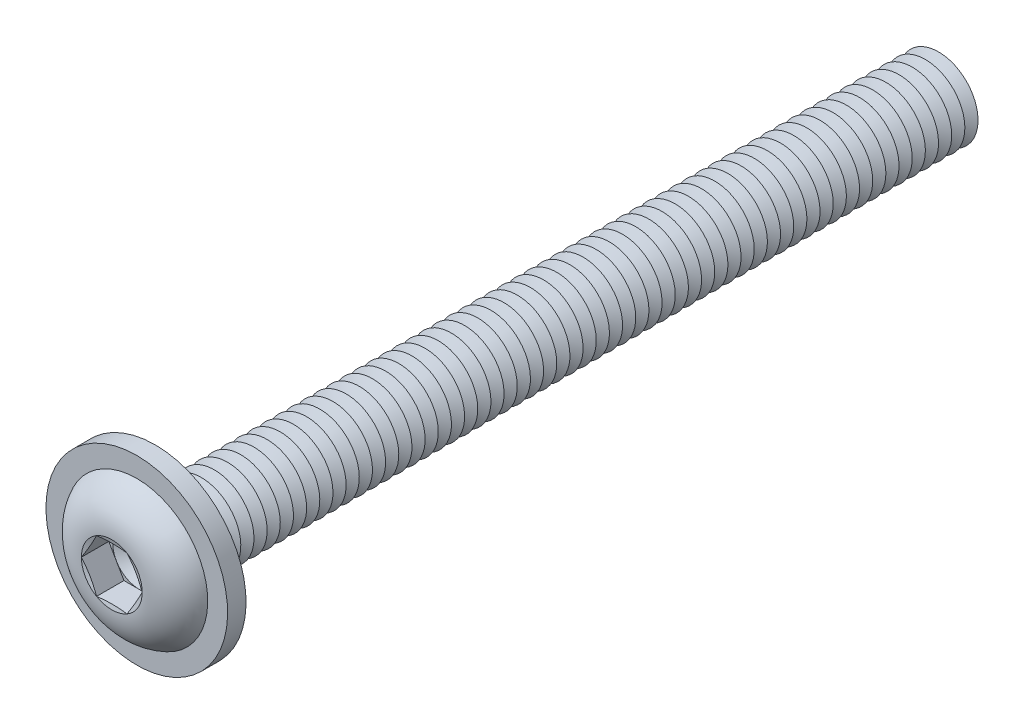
SolidWorks part; units mm, degrees
ref_plane "Front Plane" through (0, 0, 0) normal (0, 0, 1) x (1, 0, 0)
ref_plane "Top Plane" through (0, 0, 0) normal (0, 1, 0) x (1, 0, 0)
ref_plane "Right Plane" through (0, 0, 0) normal (1, 0, 0) x (0, 0, -1)
sketch "Sketch1" plane through (0, 0, 0) normal (1, 0, 0) x (0, 0, -1)
  line L0 (0, 1.5) -> (0, 2.85)
  line L3 (0, 1.5) -> (30, 1.5)
  line L4 (30, 1.5) -> (30, 0)
  line L5 (30, 0) -> (-1.65, 0) construction
  line L6 (-1.65, 0) -> (30, 0)
  line L7 (-1.65, 1.1547) -> (-1.65, 0.5773) construction
  line L8 (-1.65, 0.5773) -> (-1.65, 0)
  line L9 (-1.65, 1.1547) -> (-1.4953, 0.5773)
  line L10 (-1.4953, 0.5773) -> (-1.65, 0.5773)
  line L11 (30, 0) -> (22.7481, 0) construction
  line L12 (0, 2.85) -> (-1.65, 2.85) construction
  arc A1 (0, 2.85) -> (-1.65, 1.1547) centre (0, 1.1994) ccw
  point P8 (30, 0.75)
  dimension "D1" = 5.7
  dimension "D2" = 3
  dimension "D3" = 1.65
  dimension "D4" = 2.3094
  dimension "D5" = 30
  dimension "D6" = 15
revolve "Revolve1" add sketch "Sketch1" angle 360 about L5
fillet "Fillet1" radius 0.25 1 edges at (0, 1.5, 0)
sketch "Sketch2" plane through (0, 0, 0) normal (1, 0, 0) x (0, 0, -1)
  line L0 (29.75, 1.5) -> (30.25, 1.5)
  line L1 (30, 1.5) -> (0.25, 1.5) construction
  line L2 (30.25, 1.5) -> (30, 1.067)
  line L3 (30, -1.5) -> (30, 1.5) construction
  line L4 (30, 1.067) -> (29.75, 1.5)
  dimension "D1" = 0.5
revolve "Cut-Revolve1" cut sketch "Sketch2" angle 360 about axis through (0, 0, -30) along (0, 0, -1)
pattern_linear "LPattern1" count 60 spacing 0.5 along (0, 0, 1) of "Cut-Revolve1"
sketch "Sketch3" plane through (0, 0, 1.65) normal (0, 0, 1) x (1, 0, 0)
  line L7 (0.5773, 1) -> (-0.5774, 1)
  line L8 (-0.5774, 1) -> (-1.1547, 0)
  line L9 (-1.1547, 0) -> (-0.5773, -1)
  line L10 (-0.5773, -1) -> (0.5773, -1)
  line L11 (0.5773, -1) -> (1.1547, 0)
  line L12 (1.1547, 0) -> (0.5773, 1)
  circle A0 centre (0, 0) radius 1 construction
  circle A3 centre (0, 0) radius 1.1547 construction
extrude "Cut-Extrude1" cut sketch "Sketch3" against normal blind 1.04
sketch "Sketch4" plane through (0, 0, 0.61) normal (0, 0, 1) x (1, 0, 0)
  line L1 (0.5773, 1) -> (-0.5774, 1) construction
  circle A0 centre (0, 0) radius 1
extrude "Cut-Extrude2" cut sketch "Sketch4" against normal through all draft 60
sketch "Sketch5" plane through (0, 0, 0) normal (0, 0, -1) x (-1, 0, 0)
  circle A0 centre (0, 0) radius 3.45
  circle A1 centre (0, 0) radius 1.75
  circle A2 centre (0, 0) radius 1.75 construction
  dimension "D1" = 6.9
extrude "Boss-Extrude1" add sketch "Sketch5" against normal blind 0.7
